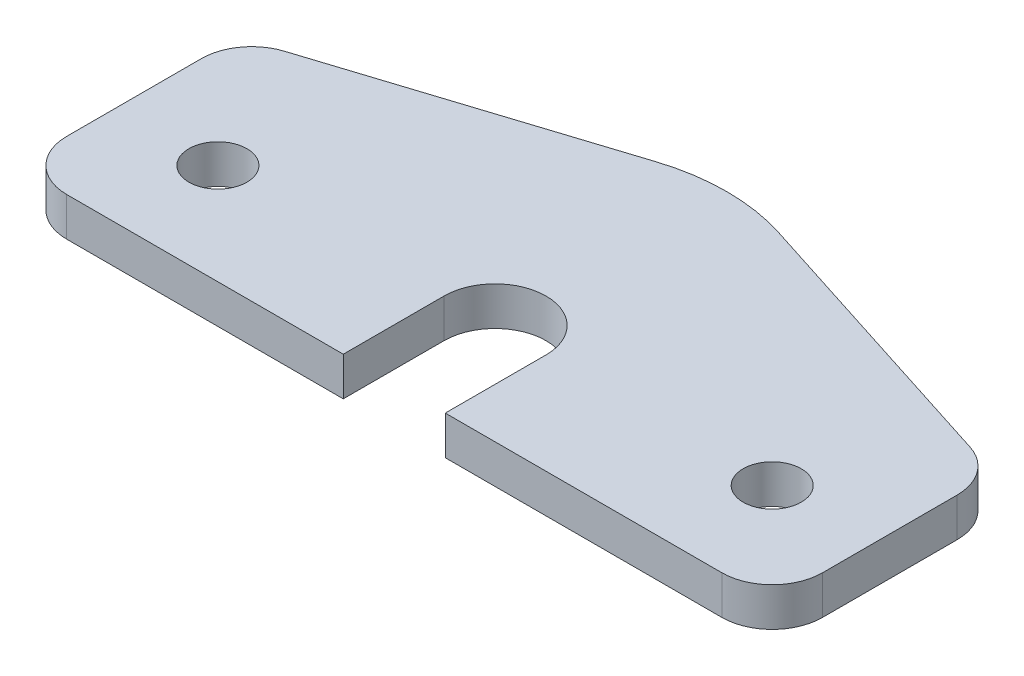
SolidWorks part; units mm, degrees
ref_plane "Front Plane" through (0, 0, 0) normal (0, 0, 1) x (1, 0, 0)
ref_plane "Top Plane" through (0, 0, 0) normal (0, 1, 0) x (1, 0, 0)
ref_plane "Right Plane" through (0, 0, 0) normal (1, 0, 0) x (0, 0, -1)
sketch "Sketch1" plane through (0, 0, 0) normal (0, 1, 0) x (1, 0, 0)
  line L0 (0, 0) -> (0, 55.5682) construction
  line L1 (0, 0) -> (54.928, 0) construction
  line L2 (-23.8125, -6.35) -> (-3.2131, -6.35)
  line L3 (-3.2131, 0) -> (-3.2131, -6.35)
  line L4 (3.2131, 0) -> (3.2131, -6.35)
  line L5 (3.2131, -6.35) -> (23.8125, -6.35)
  line L6 (23.8125, -6.35) -> (23.8125, 7.62)
  line L8 (23.8125, 7.62) -> (3.8703, 14.0009)
  line L9 (-23.8125, 7.62) -> (-3.8703, 14.0009)
  line L10 (-23.8125, -6.35) -> (-23.8125, 7.62)
  arc A0 (3.2131, 0) -> (-3.2131, 0) centre (0, 0) ccw
  circle A1 centre (17.4625, 0) radius 1.8288
  circle A2 centre (-17.4625, 0) radius 1.8288
  arc A3 (3.8703, 14.0009) -> (-3.8703, 14.0009) centre (0, 1.905) ccw
  dimension "D1" = 3.6576
  dimension "D2" = 6.4262
  dimension "D3" = 34.925
  dimension "D6" = 6.35
  dimension "D8" = 12.7
  dimension "D4" = 47.625
  dimension "D5" = 13.97
  dimension "D9" = 20.955
extrude "Boss-Extrude1" add sketch "Sketch1" along normal blind 2.4384
fillet "Fillet1" radius 3.175 4 edges at (-23.8125, 1.2192, 6.35) (23.8125, 1.2192, 6.35) (23.8125, 1.2192, -7.62) (-23.8125, 1.2192, -7.62)
